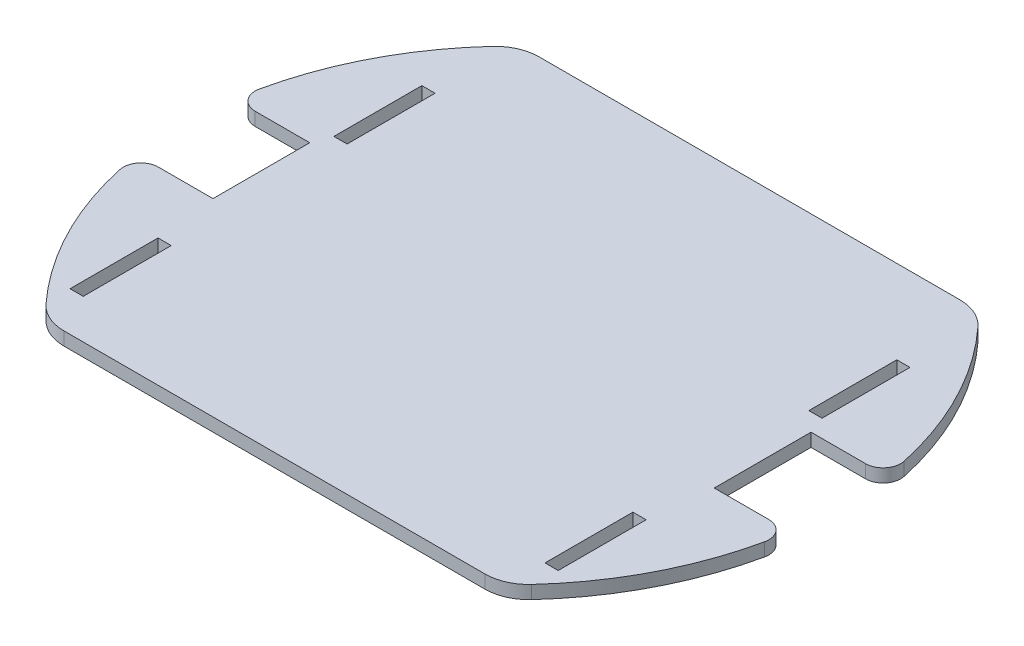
SolidWorks part; units mm, degrees
ref_plane "Front Plane" through (0, 0, 0) normal (0, 0, 1) x (1, 0, 0)
ref_plane "Top Plane" through (0, 0, 0) normal (0, 1, 0) x (1, 0, 0)
ref_plane "Right Plane" through (0, 0, 0) normal (1, 0, 0) x (0, 0, -1)
sketch "Sketch1" plane through (0, 0, 0) normal (0, 1, 0) x (1, 0, 0)
  line L0 (-52.0481, 54) -> (52.0481, 54)
  line L1 (-52.0481, -54) -> (52.0481, -54)
  line L2 (-55, 0) -> (55, 0) construction
  line L3 (74.1889, 11) -> (57, 11)
  line L4 (57, 11) -> (57, -11)
  line L5 (57, -11) -> (74.1889, -11)
  line L7 (-74.1889, 11) -> (-57, 11)
  line L8 (-57, 11) -> (-57, -11)
  line L9 (-57, -11) -> (-74.1889, -11)
  arc A0 (-52.0481, 54) -> (-74.1889, 11) centre (0, 0) ccw
  arc A1 (52.0481, -54) -> (74.1889, -11) centre (0, 0) ccw
  arc A2 (74.1889, 11) -> (52.0481, 54) centre (0, 0) ccw
  arc A3 (-74.1889, -11) -> (-52.0481, -54) centre (0, 0) ccw
  point P5 (0, 54)
  point P11 (57, 0)
  point P18 (-57, 0)
  dimension "D1" = 150
  dimension "D2" = 54
  dimension "D4" = 57
  dimension "D3" = 54
  dimension "D5" = 11
  dimension "D6" = 11
  dimension "D7" = 11
  dimension "D8" = 57
extrude "Boss-Extrude1" add sketch "Sketch1" along normal blind 3
sketch "Sketch2" plane through (0, 3, 0) normal (0, 1, 0) x (1, 0, 0)
  line L0 (-52.0481, -54) -> (52.0481, -54) construction
  line L1 (52.5, 35) -> (55.5, 35)
  line L2 (52.5, 35) -> (52.5, 15)
  line L3 (52.5, 15) -> (55.5, 15)
  line L4 (55.5, 35) -> (55.5, 15)
  line L5 (52.5, -25) -> (55.5, -25)
  line L6 (52.5, -25) -> (52.5, -45)
  line L7 (52.5, -45) -> (55.5, -45)
  line L8 (55.5, -25) -> (55.5, -45)
  line L9 (57, -11) -> (57, 11) construction
  line L10 (0, -1.65) -> (0, 1.65) construction
  line L11 (-55.5, 35) -> (-55.5, 15)
  line L12 (-52.5, 15) -> (-55.5, 15)
  line L13 (-52.5, 35) -> (-52.5, 15)
  line L14 (-52.5, 35) -> (-55.5, 35)
  line L15 (-55.5, -25) -> (-55.5, -45)
  line L16 (-52.5, -45) -> (-55.5, -45)
  line L17 (-52.5, -25) -> (-52.5, -45)
  line L18 (-52.5, -25) -> (-55.5, -25)
  dimension "D1" = 20
  dimension "D2" = 3
  dimension "D3" = 20
  dimension "D4" = 9
  dimension "D5" = 40
  dimension "D6" = 1.5
  dimension "D7" = 3
  dimension "D8" = 1.5
extrude "Cut-Extrude3" cut sketch "Sketch2" against normal blind 10
fillet "Fillet1" radius 10 4 edges at (-52.0481, 1.5, -54) (-52.0481, 1.5, 54) (52.0481, 1.5, 54) (52.0481, 1.5, -54)
fillet "Fillet2" radius 4 4 edges at (-74.1889, 1.5, 11) (-74.1889, 1.5, -11) (74.1889, 1.5, 11) (74.1889, 1.5, -11)
sketch "Sketch3" plane through (0, 3, 0) normal (0, 1, 0) x (1, 0, 0)
  line L0 (-52.5, 15) -> (-52.5, 35) construction
  line L1 (-42, 45.75) -> (-1, 45.75)
  line L2 (-42, 45.75) -> (-42, -45.75)
  line L3 (-42, -45.75) -> (-1, -45.75)
  line L4 (-1, 45.75) -> (-1, -45.75)
  line L5 (1, 45.75) -> (42, 45.75)
  line L6 (1, 45.75) -> (1, -45.75)
  line L7 (1, -45.75) -> (42, -45.75)
  line L8 (42, 45.75) -> (42, -45.75)
  line L9 (47.8435, 54) -> (-47.8435, 54) construction
  line L10 (-47.8435, -54) -> (47.8435, -54) construction
  line L11 (52.5, -25) -> (52.5, -45) construction
  dimension "D1" = 10.5
  dimension "D2" = 8.25
  dimension "D3" = 8.25
  dimension "D4" = 8.25
  dimension "D5" = 8.25
  dimension "D6" = 10.5
  dimension "D7" = 41
  dimension "D8" = 41
